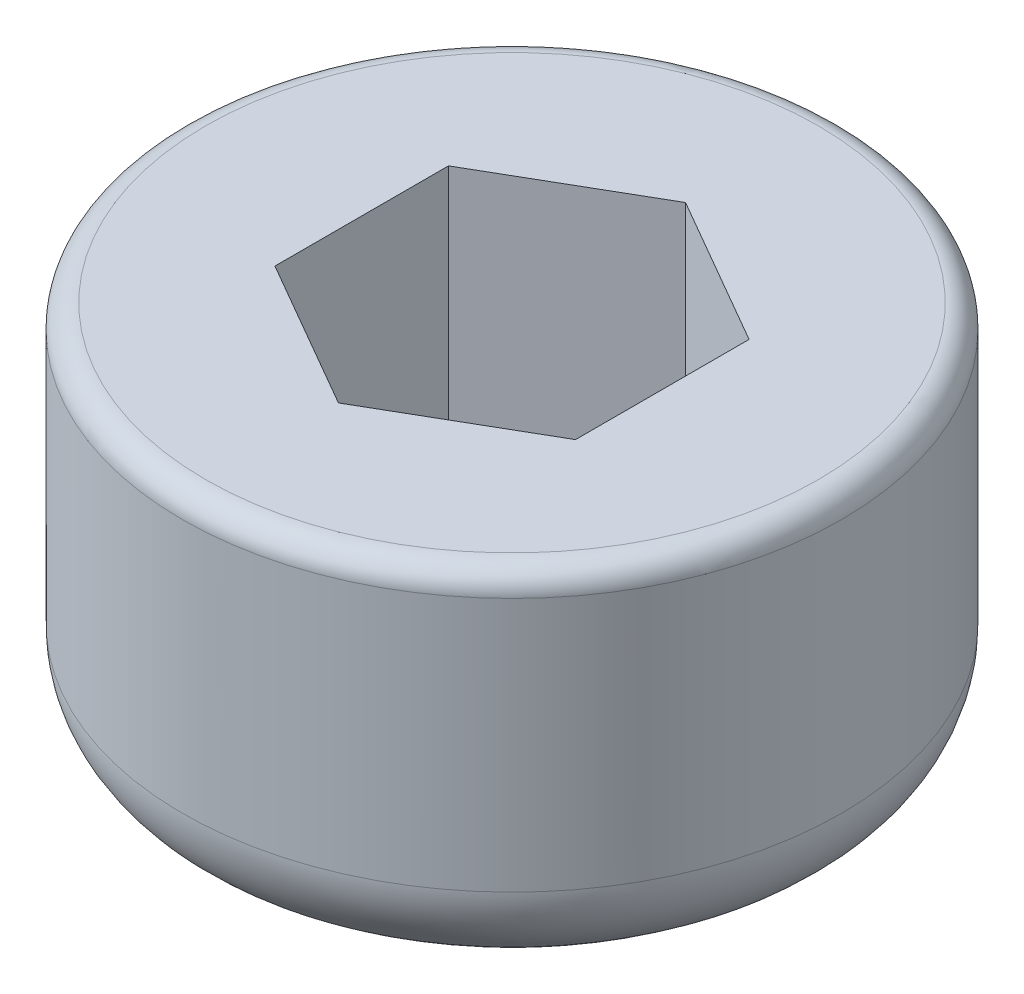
SolidWorks part; units mm, degrees
ref_plane "Alzado" through (0, 0, 0) normal (0, 0, 1) x (1, 0, 0)
ref_plane "Planta" through (0, 0, 0) normal (0, 1, 0) x (1, 0, 0)
ref_plane "Vista lateral" through (0, 0, 0) normal (1, 0, 0) x (0, 0, -1)
sketch "Croquis1" plane through (0, 0, 0) normal (0, 0, 1) x (1, 0, 0)
  line L1 (0, 0) -> (10.25, 0)
  line L2 (0, 0) -> (0, 16)
  line L3 (0, 16) -> (14.25, 16)
  line L4 (14.25, 4) -> (14.25, 16)
  arc A0 (14.25, 4) -> (10.25, 0) centre (10.25, 4) cw
  point P7 (14.25, 0)
  dimension "D3" = 4
  dimension "D1" = 14.25
  dimension "D2" = 16
revolve "Revolución1" add sketch "Croquis1" angle 360 about L2
sketch "Croquis2" plane through (0, 16, 0) normal (0, 1, 0) x (1, 0, 0)
  line L1 (0, 7.5056) -> (-6.5, 3.7528)
  line L2 (-6.5, 3.7528) -> (-6.5, -3.7528)
  line L3 (-6.5, -3.7528) -> (0, -7.5056)
  line L4 (0, -7.5056) -> (6.5, -3.7528)
  line L5 (6.5, -3.7528) -> (6.5, 3.7528)
  line L6 (6.5, 3.7528) -> (0, 7.5056)
  circle A0 centre (0, 0) radius 6.5 construction
extrude "Cortar-Extruir1" cut sketch "Croquis2" against normal through all
fillet "Redondeo1" radius 1 1 edges at (14.25, 16, 0)
